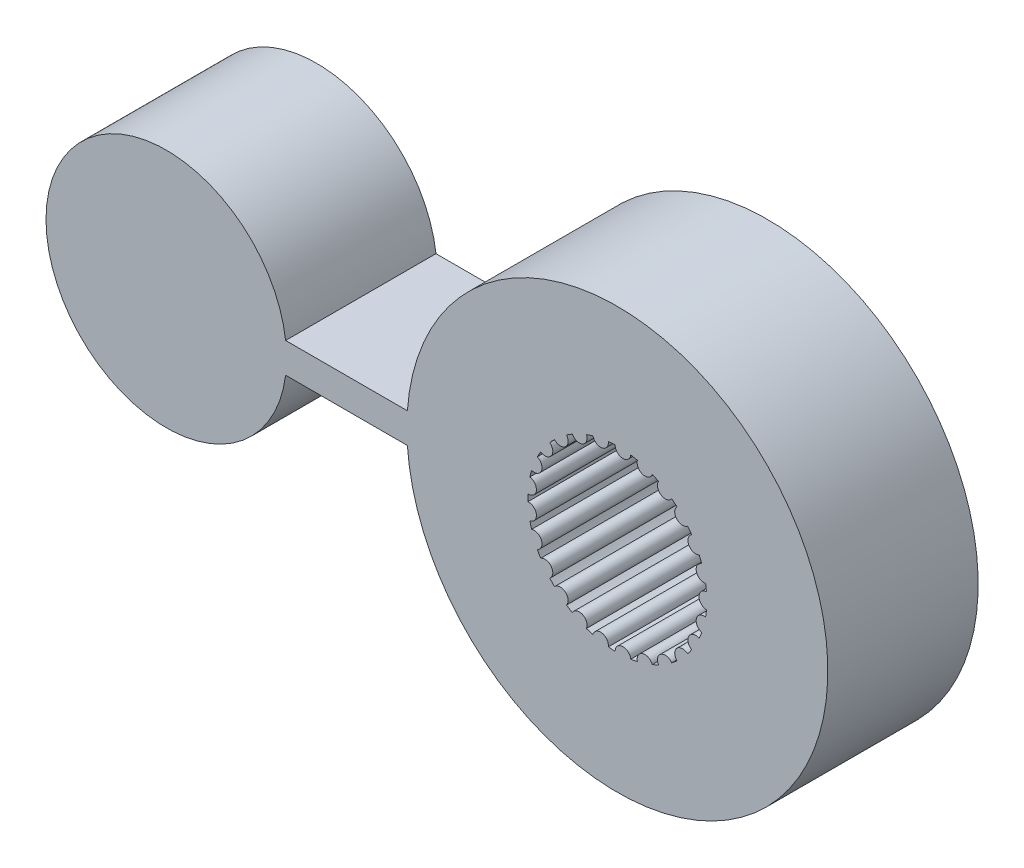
SolidWorks part; units mm, degrees
ref_plane "Plan de face" through (0, 0, 0) normal (0, 0, 1) x (1, 0, 0)
ref_plane "Plan de dessus" through (0, 0, 0) normal (0, 1, 0) x (1, 0, 0)
ref_plane "Plan de droite" through (0, 0, 0) normal (1, 0, 0) x (0, 0, -1)
sketch "Esquisse1" plane through (0, 0, 0) normal (0, 0, 1) x (1, 0, 0)
  line L0 (0, 0) -> (-30, 0) construction
  line L2 (-11.0314, 0.5) -> (-6.9821, 0.5)
  line L4 (-11.0314, -0.5) -> (-6.9821, -0.5)
  circle A0 centre (0, 0) radius 2.975
  arc A1 (-6.9821, -0.5) -> (-6.9821, 0.5) centre (0, 0) ccw
  arc A2 (-11.0314, 0.5) -> (-11.0314, -0.5) centre (-15, 0) ccw
  point P5 (-8.3711, 0)
  dimension "D1" = 5.95
  dimension "D2" = 14
  dimension "D3" = 15
  dimension "D4" = 8
  dimension "D5" = 1
  dimension "D6" = 0.5
extrude "Boss.-Extru.1" add sketch "Esquisse1" along normal blind 5
sketch "Esquisse2" plane through (0, 0, 5) normal (0, 0, 1) x (1, 0, 0)
  circle A0 centre (2.975, 0) radius 0.26
  circle A1 centre (0, 0) radius 2.975 construction
  circle A2 centre (2.8815, -0.7399) radius 0.26
  circle A3 centre (2.607, -1.4332) radius 0.26
  circle A4 centre (2.1687, -2.0365) radius 0.26
  circle A5 centre (1.5941, -2.5119) radius 0.26
  circle A6 centre (0.9193, -2.8294) radius 0.26
  circle A7 centre (0.1868, -2.9691) radius 0.26
  circle A8 centre (-0.5575, -2.9223) radius 0.26
  circle A9 centre (-1.2667, -2.6919) radius 0.26
  circle A10 centre (-1.8963, -2.2923) radius 0.26
  circle A11 centre (-2.4068, -1.7487) radius 0.26
  circle A12 centre (-2.7661, -1.0952) radius 0.26
  circle A13 centre (-2.9515, -0.3729) radius 0.26
  circle A14 centre (-2.9515, 0.3729) radius 0.26
  circle A15 centre (-2.7661, 1.0952) radius 0.26
  circle A16 centre (-2.4068, 1.7487) radius 0.26
  circle A17 centre (-1.8963, 2.2923) radius 0.26
  circle A18 centre (-1.2667, 2.6919) radius 0.26
  circle A19 centre (-0.5575, 2.9223) radius 0.26
  circle A20 centre (0.1868, 2.9691) radius 0.26
  circle A21 centre (0.9193, 2.8294) radius 0.26
  circle A22 centre (1.5941, 2.5119) radius 0.26
  circle A23 centre (2.1687, 2.0365) radius 0.26
  circle A24 centre (2.607, 1.4332) radius 0.26
  circle A25 centre (2.8815, 0.7399) radius 0.26
  point P55 (0, 0)
  dimension "D1" = 0.52
  dimension "D2" = 25
extrude "Boss.-Extru.2" add sketch "Esquisse2" against normal blind 5
